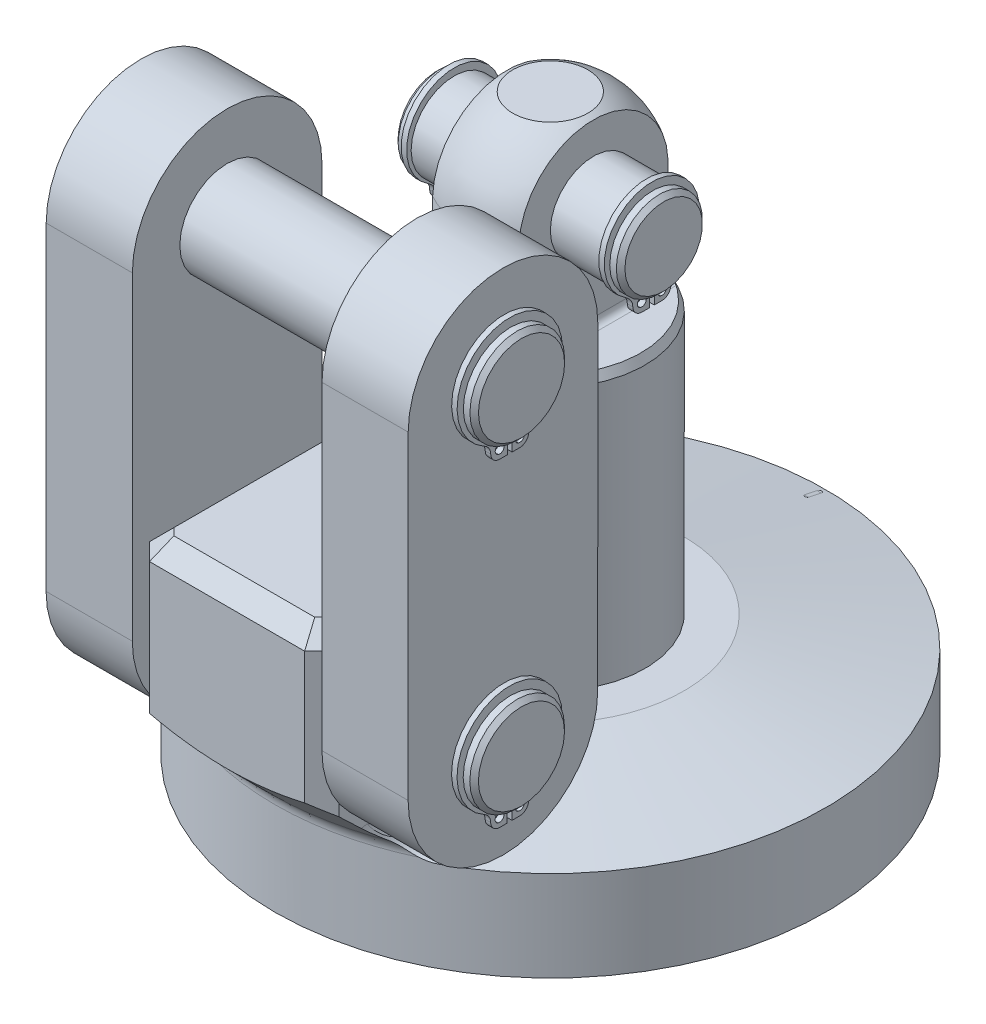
SolidWorks part; units mm, degrees
ref_plane "Front Plane" through (0, 0, 0) normal (0, 0, 1) x (1, 0, 0)
ref_plane "Top Plane" through (0, 0, 0) normal (0, 1, 0) x (1, 0, 0)
ref_plane "Right Plane" through (0, 0, 0) normal (1, 0, 0) x (0, 0, -1)
sketch "Sketch1" plane through (0, 0, 0) normal (0, 1, 0) x (1, 0, 0)
  line L0 (-11, 0) -> (11, 0)
  line L1 (11, 0) -> (11, -37.5)
  line L2 (11, -37.5) -> (-11, -37.5)
  line L3 (-11, -37.5) -> (-11, 0)
  line L4 (0, 1.05) -> (0, -22.05) construction
  dimension "D1" = 22
  dimension "D2" = 37.5
extrude "Extrude1" add sketch "Sketch1" along normal blind 35.5
sketch "S2D0003" plane through (0, 0, 0) normal (1, 0, 0) x (0, 0, -1)
  line L0 (0, 0) -> (0, 14)
  line L1 (-37.5, 0) -> (0, 0)
  line L2 (-37.5, 0) -> (-37.5, 9.3238)
  line L3 (0, 14) -> (-15.5, 14)
  line L4 (-15.5, 14) -> (-37.5, 9.3238)
  line L5 (0, 9.45) -> (0, -2.5987) construction
  line L6 (0, 35.5) -> (0, 0) construction
  line L8 (-37.5, 0) -> (0, 0) construction
  line L10 (-37.5, 35.5) -> (-37.5, 0) construction
  dimension "D1" = 14
  dimension "D2" = 12
  dimension "D3" = 31
sketch "S2D0004" plane through (0, 0, 0) normal (1, 0, 0) x (0, 0, -1)
  line L0 (-47.5076, 27.1929) -> (-32.5536, 12.2389)
  line L1 (-31.9659, 10.82) -> (-31.9659, 0)
  line L2 (0, 16.6313) -> (0, -1.1122) construction
  line L3 (0, 35.5) -> (0, 0) construction
  line L5 (-37.5, 0) -> (0, 0) construction
  line L6 (-47.5076, 27.1929) -> (-47.5076, 0)
  line L7 (-47.5076, 0) -> (-31.9659, 0)
  line L8 (-37.5, 35.5) -> (-37.5, 0) construction
  arc A0 (-31.9659, 10.82) -> (-32.5536, 12.2389) centre (-33.9725, 10.82) ccw
  dimension "D4" = 2.0066
  dimension "D1" = 63.9318
  dimension "D2" = 10.82
  dimension "D3" = 45
  dimension "D5" = 10.0076
sketch "Sketch4" plane through (0, 0, 0) normal (1, 0, 0) x (0, 0, -1)
  line L0 (0, 14) -> (15.5, 14)
  line L1 (15.5, 14) -> (15.5, 35.5)
  line L2 (15.5, 35.5) -> (0, 35.5)
  line L3 (0, 35.5) -> (0, 14)
  line L4 (0, 21.6) -> (0, 8.4) construction
  line L5 (0, 35.5) -> (0, 0) construction
  line L6 (-37.5, 35.5) -> (0, 35.5) construction
  dimension "D1" = 31
  dimension "D2" = 21.5
revolve "Cut-Revolve5" cut sketch "Sketch4" angle 360 about L4
revolve "Revolve1" add sketch "S2D0003" angle 360 about L5
revolve "Cut-Revolve4" cut sketch "S2D0004" angle 360 about L2
sketch "Sketch7" plane through (11, 0, 0) normal (1, 0, 0) x (0, 0, -1)
  line L0 (-31.9659, 0) -> (31.9659, 0) construction
  circle A0 centre (-26.5, 24.5) radius 5.5
  dimension "D1" = 11
  dimension "D2" = 24.5
  dimension "D3" = 26.5
extrude "Cut-Extrude3" cut sketch "Sketch7" against normal through all
fillet "Fillet1" radius 3 2 edges at (-11, 24.75, 10.9202) (11, 24.75, 10.9202)
fillet "Fillet2" radius 4.76 5 edges at (-9.5428, 13.6743, 14.1079) (0, 14, 15.5) (9.5428, 13.6743, 14.1079)
chamfer "Chamfer1" distance 2 angle 45 2 edges at (-11, 27.1327, 37.5) (11, 27.1327, 37.5)
chamfer "Chamfer2" distance 2 angle 45 8 edges at (-11, 35.5, 26.0904) (-9.5981, 35.5, 14.1419) (0, 35.5, 15.5) (9.5981, 35.5, 14.1419) (-10, 35.5, 36.5) (11, 35.5, 26.0904) (10, 35.5, 36.5) (0, 35.5, 37.5)
ref_plane "Plane1" through (0, 0, 26.5) normal (0, 0, 1) x (1, 0, 0)
sketch "Sketch8" plane through (0, 0, 26.5) normal (0, 0, 1) x (1, 0, 0)
  line L0 (11, 24.5) -> (11, 12.9908)
  line L1 (12.14, 11.8508) -> (23.64, 11.8508)
  line L2 (23.64, 11.8508) -> (23.64, 24.5)
  line L3 (23.64, 24.5) -> (11, 24.5)
  line L4 (5.637, 24.5) -> (19.4125, 24.5) construction
  line L5 (-11, 24.5) -> (11, 24.5) construction
  line L6 (11, 35.5) -> (11, 18.7653) construction
  line L7 (0, 0) -> (0, 26.6501) construction
  line L8 (-23.64, 24.5) -> (-11, 24.5)
  line L9 (-23.64, 11.8508) -> (-23.64, 24.5)
  line L10 (-12.14, 11.8508) -> (-23.64, 11.8508)
  line L11 (-11, 24.5) -> (-11, 12.9908)
  arc A0 (11, 12.9908) -> (12.14, 11.8508) centre (12.14, 12.9908) ccw
  arc A1 (-11, 12.9908) -> (-12.14, 11.8508) centre (-12.14, 12.9908) cw
  dimension "D4" = 1.14
  dimension "D2" = 25.2984
  dimension "D3" = 12.64
revolve "Cut-Revolve6" cut sketch "Sketch8" angle 360 about L4
sketch "Sketch10" plane through (0, 0, 0) normal (1, 0, 0) x (0, 0, -1)
  line L0 (0, 14) -> (0, 66.4827)
  line L1 (0, 66.4827) -> (4.3589, 66.4827)
  line L2 (9.9949, 57.802) -> (9.9949, 46.6343)
  line L3 (9.9949, 46.6343) -> (10.9982, 44.4827)
  line L4 (10.9982, 44.4827) -> (10.9982, 14)
  line L5 (10.9982, 14) -> (0, 14)
  line L6 (0, 44.745) -> (0, 7.55) construction
  line L7 (22.759, -20) -> (-24.5324, -20) construction
  line L9 (15.5, 14) -> (-9.8797, 14) construction
  arc A0 (9.9949, 57.802) -> (4.3589, 66.4827) centre (0, 57.4827) ccw
  circle A1 centre (0, 57.4827) radius 5 construction
  dimension "D2" = 10
  dimension "D3" = 10
  dimension "D5" = 77.4827
  dimension "D1" = 9
  dimension "D4" = 34
  dimension "D6" = 21.9964
  dimension "D7" = 19.9898
  dimension "D8" = 25
  dimension "D9" = 22
  dimension "D10" = 30.4827
  dimension "D11" = 52.4827
revolve "Revolve2" add sketch "Sketch10" angle 360 about L6
sketch "Sketch12" plane through (0, 0, 0) normal (0, 0, 1) x (1, 0, 0)
  line L0 (5, 66.4827) -> (10.9982, 66.4827)
  line L1 (10.9982, 66.4827) -> (10.9982, 45.4827)
  line L2 (10.9982, 45.4827) -> (5.8, 45.4827)
  line L3 (5, 46.2827) -> (5, 66.4827)
  line L4 (4.3589, 66.4827) -> (-4.3589, 66.4827) construction
  line L5 (10.9982, 14) -> (10.9982, 44.4827) construction
  line L6 (-5, 46.2827) -> (-5, 66.4827)
  line L7 (-10.9982, 45.4827) -> (-5.8, 45.4827)
  line L8 (0, 38.525) -> (0, 26.975) construction
  line L9 (-10.9982, 66.4827) -> (-10.9982, 45.4827)
  line L10 (-5, 66.4827) -> (-10.9982, 66.4827)
  arc A0 (5, 46.2827) -> (5.8, 45.4827) centre (5.8, 46.2827) ccw
  arc A1 (-5, 46.2827) -> (-5.8, 45.4827) centre (-5.8, 46.2827) cw
  dimension "D3" = 0.8
  dimension "D1" = 10
  dimension "D2" = 21
extrude "Cut-Extrude5" cut sketch "Sketch12" against normal mid plane 20
sketch "Sketch14" plane through (5, 0, 0) normal (1, 0, 0) x (0, 0, -1)
  line L0 (4.3589, 66.4827) -> (-4.3589, 66.4827) construction
  circle A0 centre (0, 57.4827) radius 5
  dimension "D2" = 10
  dimension "D1" = 9
extrude "Cut-Extrude7" cut sketch "Sketch14" against normal up to next
sketch "S2D0005" plane through (11, 0, 0) normal (1, 0, 0) x (0, 0, -1)
  line L0 (-37.4877, 61.5036) -> (-37.5, 24.5036)
  line L1 (-15.4877, 61.4964) -> (-15.5, 24.4964)
  line L2 (-26.4877, 61.5) -> (-26.5, 24.5) construction
  line L3 (0, 57.4827) -> (0.0044, 61.4705) construction
  line L4 (0.0044, 61.4705) -> (-26.4877, 61.5) construction
  arc A0 (-15.4877, 61.4964) -> (-37.4877, 61.5036) centre (-26.4877, 61.5) ccw
  arc A1 (-37.5, 24.5036) -> (-15.5, 24.4964) centre (-26.5, 24.5) ccw
  circle A2 centre (-26.4877, 61.5) radius 5.5
  circle A3 centre (-26.5, 24.5) radius 5.5
  circle A6 centre (-26.5, 24.5) radius 5.5 construction
  dimension "D2" = 37
  dimension "D1" = 22
  dimension "D3" = 26.4922
  dimension "D4" = 3.9878
extrude "Extrude2" add sketch "S2D0005" along normal blind 10
sketch "S2D0006" plane through (0, 0, 0) normal (0, 0, 1) x (1, 0, 0)
  line L0 (-11.15, 62.4827) -> (11.15, 62.4827)
  line L1 (13.15, 61.9827) -> (13.15, 57.4827)
  line L2 (12.65, 62.4827) -> (13.15, 61.9827)
  line L3 (11.89, 62.4827) -> (12.65, 62.4827)
  line L4 (11.89, 62.1677) -> (11.89, 62.4827)
  line L5 (11.15, 62.1677) -> (11.89, 62.1677)
  line L6 (11.15, 62.4827) -> (11.15, 62.1677)
  line L7 (13.15, 57.4827) -> (-13.15, 57.4827)
  line L8 (-11.15, 62.4827) -> (-11.15, 62.1677)
  line L9 (-11.15, 62.1677) -> (-11.89, 62.1677)
  line L10 (-11.89, 62.1677) -> (-11.89, 62.4827)
  line L11 (-11.89, 62.4827) -> (-12.65, 62.4827)
  line L12 (-12.65, 62.4827) -> (-13.15, 61.9827)
  line L13 (-13.15, 61.9827) -> (-13.15, 57.4827)
  line L14 (-8.415, 57.4827) -> (8.415, 57.4827) construction
  line L15 (-5, 57.4827) -> (5, 57.4827) construction
  line L16 (0, 40.8686) -> (0, 24.9357) construction
  line L17 (0, 46.6343) -> (0, 57.802) construction
  line L18 (5, 62.4827) -> (-5, 62.4827) construction
  dimension "D1" = 26.3
  dimension "D3" = 0.74
  dimension "D4" = 9.37
  dimension "D5" = 22.3
  dimension "D6" = 0.5
  dimension "D7" = 45
revolve "Revolve3" add sketch "S2D0006" angle 360 about L14
ref_plane "Plane2" through (0, 0, 26.5) normal (0, 0, 1) x (1, 0, 0)
sketch "Sketch18" plane through (0, 0, 26.5) normal (0, 0, 1) x (1, 0, 0)
  line L0 (-21.15, 30) -> (21.15, 30)
  line L1 (23.15, 29.5) -> (23.15, 24.5)
  line L2 (22.65, 30) -> (23.15, 29.5)
  line L3 (21.89, 30) -> (22.65, 30)
  line L4 (21.89, 29.73) -> (21.89, 30)
  line L5 (21.15, 29.73) -> (21.89, 29.73)
  line L6 (21.15, 30) -> (21.15, 29.73)
  line L7 (-21.15, 30) -> (-21.15, 29.73)
  line L8 (-21.15, 29.73) -> (-21.89, 29.73)
  line L9 (-21.89, 29.73) -> (-21.89, 30)
  line L10 (-21.89, 30) -> (-22.65, 30)
  line L11 (-22.65, 30) -> (-23.15, 29.5)
  line L12 (-23.15, 29.5) -> (-23.15, 24.5)
  line L13 (-13.915, 24.5) -> (13.915, 24.5) construction
  line L14 (-11, 24.5) -> (21, 24.5) construction
  line L15 (0, 28.7058) -> (0, -18.8155) construction
  line L16 (-23.15, 24.5) -> (23.15, 24.5)
  line L17 (21, 30) -> (-11, 30) construction
  dimension "D2" = 46.3
  dimension "D3" = 10.46
  dimension "D4" = 0.74
  dimension "D5" = 42.3
  dimension "D6" = 0.5
  dimension "D7" = 45
revolve "Revolve4" add sketch "Sketch18" angle 360 about L13
sketch "Sketch20" plane through (11.15, 0, 0) normal (1, 0, 0) x (0, 0, -1)
  line L0 (0.2762, 50.7852) -> (1.169, 50.7852)
  line L1 (0.2762, 52.9952) -> (0.2762, 50.7852)
  line L2 (-0.2763, 52.9952) -> (-0.2763, 50.7852)
  line L3 (-0.2763, 50.7852) -> (-1.169, 50.7852)
  line L4 (0, 30.527) -> (0, 23.2449) construction
  arc A0 (0.2762, 52.9952) -> (-0.2763, 52.9952) centre (0, 57.4827) ccw
  arc A1 (2.9036, 53.0696) -> (-2.9036, 53.0696) centre (0, 57.7721) ccw
  circle A2 centre (0, 57.4827) radius 5 construction
  circle A3 centre (1.169, 51.8262) radius 0.5205
  arc A4 (2.21, 51.8262) -> (1.169, 50.7852) centre (1.169, 51.8262) cw
  arc A5 (-2.21, 51.8262) -> (-2.9036, 53.0696) centre (-3.6714, 51.8262) ccw
  arc A6 (-2.21, 51.8262) -> (-1.169, 50.7852) centre (-1.169, 51.8262) ccw
  circle A7 centre (-1.169, 51.8262) radius 0.5205
  arc A8 (2.21, 51.8262) -> (2.9036, 53.0696) centre (3.6714, 51.8262) cw
  dimension "D1" = 0.5525
  dimension "D2" = 4.496
  dimension "D3" = 5.5266
  dimension "D4" = 0.2894
  dimension "D6" = 1.041
  dimension "D9" = 1.041
  dimension "D10" = 1.4614
  dimension "D7" = 2.338
  dimension "D8" = 5.6565
extrude "Extrude4" add sketch "Sketch20" along normal blind 0.635
sketch "Sketch21" plane through (21.15, 0, 0) normal (1, 0, 0) x (0, 0, -1)
  line L0 (-26.223, 17.2573) -> (-25.3334, 17.257)
  line L1 (-26.2223, 19.4927) -> (-26.223, 17.2573)
  line L2 (-26.781, 19.4929) -> (-26.7818, 17.2575)
  line L3 (-26.7818, 17.2575) -> (-27.6714, 17.2578)
  line L4 (-26.5057, 7.2804) -> (-26.5078, 0.9847) construction
  line L5 (-37.4877, 61.5036) -> (-37.5, 24.5036) construction
  arc A0 (-26.2223, 19.4927) -> (-26.781, 19.4929) centre (-26.5, 24.5) ccw
  arc A1 (-23.6196, 19.4058) -> (-29.3838, 19.4077) centre (-26.4999, 24.7984) ccw
  circle A2 centre (-25.3331, 18.298) radius 0.5205
  arc A3 (-24.2921, 18.2918) -> (-25.3334, 17.257) centre (-25.3331, 18.298) cw
  arc A4 (-24.2921, 18.2918) -> (-23.6196, 19.4058) centre (-23.0205, 18.2842) cw
  arc A5 (-28.712, 18.2933) -> (-29.3838, 19.4077) centre (-29.9836, 18.2865) ccw
  arc A6 (-28.712, 18.2933) -> (-27.6714, 17.2578) centre (-27.6711, 18.2988) ccw
  circle A7 centre (-27.6711, 18.2988) radius 0.5205
  circle A8 centre (-26.5, 24.5) radius 5.5 construction
  dimension "D1" = 5.015
  dimension "D2" = 6.1136
  dimension "D3" = 0.2984
  dimension "D7" = 1.041
  dimension "D8" = 1.041
  dimension "D9" = 6.2012
  dimension "D10" = 1.2716
  dimension "D4" = 0.5587
  dimension "D6" = 2.338
extrude "Extrude5" add sketch "Sketch21" along normal blind 0.635
pattern_linear "LPattern1" count 2 spacing 37 along (0, 1, -0.0003) of "Extrude5", "Revolve4"
mirror "Mirror1" about plane through (0, 0, 0) normal (1, 0, 0) of "Extrude5", "LPattern1", "Extrude4", "Extrude2"
sketch "Sketch22" plane through (0, 0, 0) normal (1, 0, 0) x (0, 0, -1)
  line L0 (32.173, 11.233) -> (29.5546, 11.7896) construction
  line L1 (31.9659, 10.5001) -> (15.5, 14) construction
  line L2 (31.4768, 10.604) -> (29.5205, 11.0198) construction
  line L3 (31.3905, 11.3993) -> (29.9229, 11.7113) construction
  line L4 (31.2242, 10.6168) -> (29.7566, 10.9288)
  line L6 (29.1404, 11.8776) -> (32.173, 11.233)
  arc A0 (31.2242, 10.6168) -> (32.173, 11.233) centre (31.3905, 11.3993) ccw
  arc A1 (29.1404, 11.8776) -> (29.7566, 10.9288) centre (29.9229, 11.7113) ccw
  dimension "D1" = 1.6
  dimension "D2" = 2
  dimension "D3" = 0.5
  dimension "D4" = 0.76
  dimension "D5" = 0.04
revolve "Cut-Revolve7" cut sketch "Sketch22" angle 360 about L6
